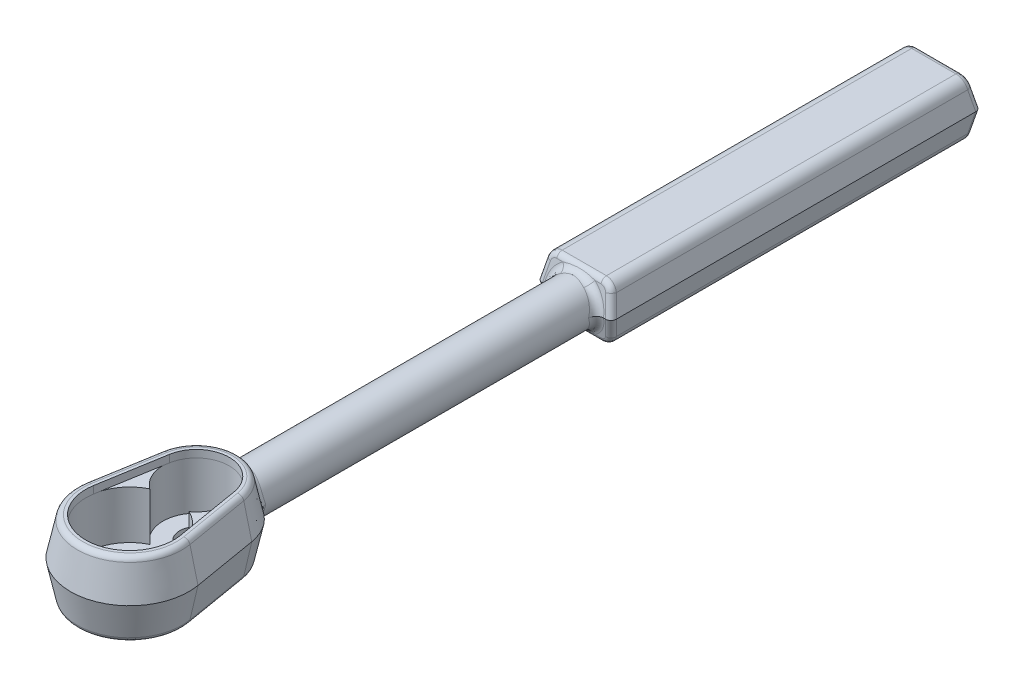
SolidWorks part; units mm, degrees
ref_plane "Front Plane" through (0, 0, 0) normal (0, 0, 1) x (1, 0, 0)
ref_plane "Top Plane" through (0, 0, 0) normal (0, 1, 0) x (1, 0, 0)
ref_plane "Right Plane" through (0, 0, 0) normal (1, 0, 0) x (0, 0, -1)
sketch "Sketch1" plane through (0, 0, 0) normal (0, 1, 0) x (1, 0, 0)
  line L0 (0, 0) -> (0, 120) construction
  line L1 (-10, 220) -> (10, 220)
  line L2 (-10, 220) -> (-10, 120)
  line L3 (-10, 120) -> (10, 120)
  line L4 (10, 220) -> (10, 120)
  dimension "D1" = 220
  dimension "D2" = 100
  dimension "D3" = 20
extrude "Handle" add sketch "Sketch1" along normal mid plane 15 draft 12
sketch "Sketch3" plane through (0, 0, 0) normal (0, 0, 1) x (1, 0, 0)
  circle A0 centre (0, 0) radius 6
  dimension "D1" = 12
extrude "Transition" add sketch "Sketch3" against normal up to next
sketch "Sketch4" plane through (0, 0, 0) normal (0, 1, 0) x (1, 0, 0)
  line L0 (-15.7762, 2.6667) -> (-12.8182, 20.1667)
  line L1 (12.8182, 20.1667) -> (15.7762, 2.6667)
  line L2 (0, 0) -> (0, 120) construction
  arc A0 (-12.8182, 20.1667) -> (12.8182, 20.1667) centre (0, 18) cw
  arc A1 (15.7762, 2.6667) -> (-15.7762, 2.6667) centre (0, 0) cw
  dimension "D1" = 16
  dimension "D2" = 13
  dimension "D3" = 18
  dimension "D4" = 19.188
extrude "Head" add sketch "Sketch4" along normal mid plane 20
sketch "Sketch5" plane through (0, 10, 0) normal (0, 1, 0) x (-1, 0, 0)
  line L4 (-11.7084, -1.9791) -> (-8.7503, -19.4791)
  line L5 (8.7503, -19.4791) -> (11.7084, -1.9791)
  line L6 (-11.7084, -1.9791) -> (-8.7503, -19.4791)
  line L7 (8.7503, -19.4791) -> (11.7084, -1.9791)
  arc A4 (11.7084, -1.9791) -> (-11.7084, -1.9791) centre (0, 0) ccw
  arc A5 (-8.7503, -19.4791) -> (8.7503, -19.4791) centre (0, -18) ccw
  arc A6 (11.7084, -1.9791) -> (-11.7084, -1.9791) centre (0, 0) ccw
  arc A7 (-8.7503, -19.4791) -> (8.7503, -19.4791) centre (0, -18) ccw
  dimension "D1" = 2
extrude "Recess" cut sketch "Sketch5" against normal blind 2
sketch "Sketch6" plane through (0, 8, 0) normal (0, 1, 0) x (-1, 0, 0)
  arc A0 (5.3327, -10.75) -> (-5.3327, -10.75) centre (0, 0) ccw
  arc A1 (-5.3327, -10.75) -> (5.3327, -10.75) centre (0, -18) ccw
  arc A2 (-8.7503, -19.4791) -> (8.7503, -19.4791) centre (0, -18) ccw construction
  dimension "D1" = 18
  dimension "D2" = 24
extrude "Pocket" cut sketch "Sketch6" against normal blind 13
sketch "Sketch7" plane through (0, -5, 0) normal (0, 1, 0) x (-1, 0, 0)
  circle A0 centre (0, -18) radius 4.5
  dimension "D1" = 9
extrude "Wheel Hole" cut sketch "Sketch7" against normal through all
sketch "Sketch8" plane through (-2.9289, -5, 14.3981) normal (0, 1, 0) x (-1, 0, 0)
  circle A0 centre (-2.9289, -14.3981) radius 6
  arc A1 (2.4038, -25.1481) -> (-8.2616, -25.1481) centre (-2.9289, -14.3981) ccw construction
  dimension "D1" = 12
extrude "Ratchet Hole" cut sketch "Sketch8" against normal through all
fillet "HandleFillets" radius 3 4 edges at (8.4058, 7.5, -170) (-8.4058, -7.5, -170) (8.4058, -7.5, -170) (-8.4058, 7.5, -170)
fillet "H End Fillets" radius 1.5 28 edges at (-7.8644, 6.8314, -121.4521) (-9.4555, 2.5619, -219.4555) (9.4555, 2.5619, -219.4555) (7.8644, 6.8314, -218.5479) (-7.8644, 6.8314, -218.5479) (0, 10, 13.8744) (12.2014, 10, -11.0624) (0, 10, -28.8744) (-12.2014, 10, -11.0624) (0, -10, 13.8744) (-12.2014, -10, -11.0624) (0, -10, -28.8744) (12.2014, -10, -11.0624) (-9.4555, -2.5619, -219.4555) (-9.4555, -2.5619, -120.5445) (0, -7.5, -121.5942) (9.4555, -2.5619, -120.5445) (7.8644, -6.8314, -121.4521) (-7.8644, -6.8314, -121.4521) (0, -7.5, -218.4058) (9.4555, -2.5619, -219.4555) (7.8644, -6.8314, -218.5479) (-7.8644, -6.8314, -218.5479) (0, 7.5, -121.5942) (0, 7.5, -218.4058) (9.4555, 2.5619, -120.5445) (-9.4555, 2.5619, -120.5445) (7.8644, 6.8314, -121.4521)
fillet "T-H Fillets" radius 2 4 edges at (0.0831, -5.9994, -29.7245) (0.0831, 5.9994, -29.7245) (0, -6, -121.2753) (0, 6, -121.2753)
